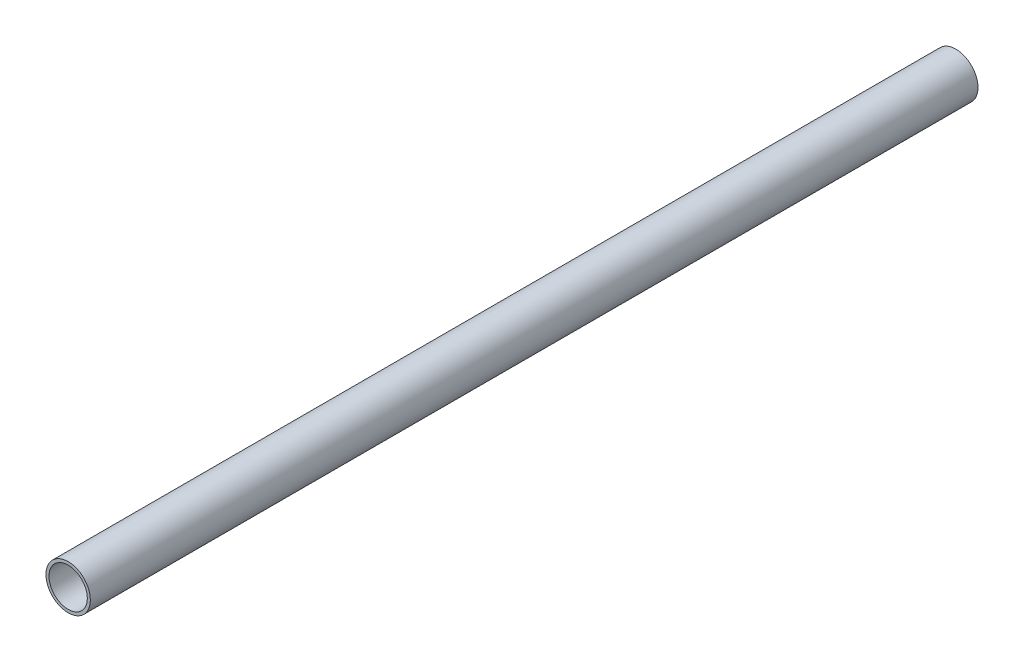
SolidWorks part; units mm, degrees
ref_plane "Alzado" through (0, 0, 0) normal (0, 0, 1) x (1, 0, 0)
ref_plane "Planta" through (0, 0, 0) normal (0, 1, 0) x (1, 0, 0)
ref_plane "Vista lateral" through (0, 0, 0) normal (1, 0, 0) x (0, 0, -1)
sketch "Croquis1" plane through (0, 0, 0) normal (0, 0, 1) x (1, 0, 0)
  circle A0 centre (0, 0) radius 11
  circle A1 centre (0, 0) radius 9.5
  dimension "D1" = 22
  dimension "D2" = 19
extrude "Saliente-Extruir1" add sketch "Croquis1" along normal blind 440
